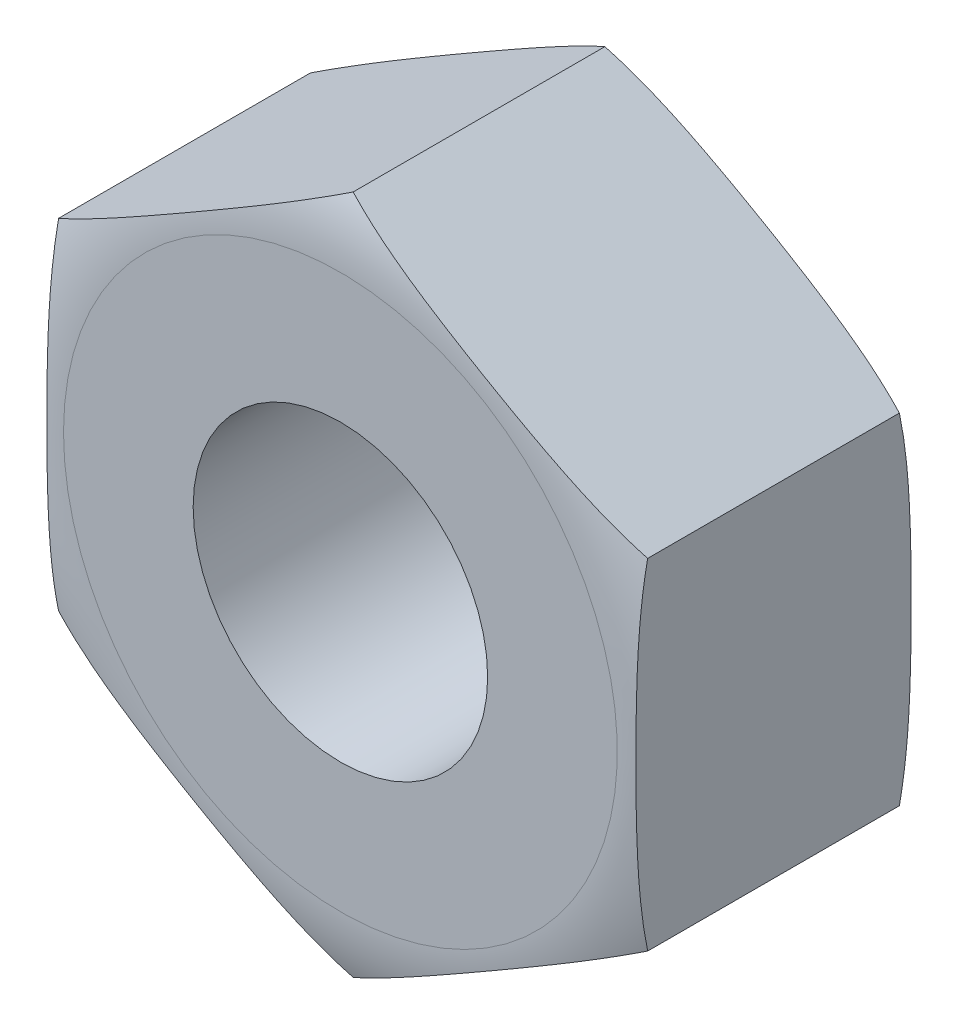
SolidWorks part; units mm, degrees
ref_plane "Ebene vorne" through (0, 0, 0) normal (0, 0, 1) x (1, 0, 0)
ref_plane "Ebene oben" through (0, 0, 0) normal (0, 1, 0) x (1, 0, 0)
ref_plane "Ebene rechts" through (0, 0, 0) normal (1, 0, 0) x (0, 0, -1)
sketch "Skizze1" plane through (0, 0, 0) normal (0, 0, 1) x (1, 0, 0)
  line L1 (8.5, 4.9075) -> (0, 9.815)
  line L2 (0, 9.815) -> (-8.5, 4.9075)
  line L3 (-8.5, 4.9075) -> (-8.5, -4.9075)
  line L4 (-8.5, -4.9075) -> (0, -9.815)
  line L5 (0, -9.815) -> (8.5, -4.9075)
  line L6 (8.5, -4.9075) -> (8.5, 4.9075)
  circle A0 centre (0, 0) radius 8.5 construction
  dimension "D1" = 17
extrude "Aufsatz-Linear austragen1" add sketch "Skizze1" along normal blind 8
hole_wizard "M10 Gewindebohrung1" positions "Skizze2" profile "Skizze3" tap size "M10" standard "DIN"
sketch "Skizze2" plane through (0, 0, 8) normal (0, 0, 1) x (1, 0, 0)
  point P0 (0, 0)
sketch "Skizze3" plane through (0, 0, 8) normal (1, 0, 0) x (0, -1, 0)
  line L0 (0, 0) -> (0, 8)
  line L1 (0, 8) -> (4.25, 8)
  line L2 (4.25, 8) -> (4.25, 0)
  line L5 (4.25, 0) -> (0, 0)
  line L11 (0, -6.35) -> (0, 107.95) construction
  dimension "Bohrerdurchmesser" = 8.5
  dimension "Bohrungstiefe" = 8
sketch "Skizze4" plane through (0, 0, 0) normal (0, 1, 0) x (1, 0, 0)
  line L0 (-10, -7.55) -> (-10, -8)
  line L1 (-10, -8) -> (-7.9915, -8)
  line L2 (-8.5, -8) -> (0, -8) construction
  line L3 (0, -8) -> (-8.5, -8) construction
  line L4 (-8.7093, -4) -> (-0.9115, -4) construction
  line L5 (0, 0) -> (-8.5, 0) construction
  line L6 (-10, 0) -> (-7.9915, 0)
  line L7 (-10, -0.45) -> (-10, 0)
  line L8 (0, -8) -> (0, 0) construction
  line L9 (0, -0.7159) -> (0, -6.0251) construction
  arc A0 (-10, -7.55) -> (-7.9915, -8) centre (-7.9915, -3.2929) ccw
  arc A1 (-10, -0.45) -> (-7.9915, 0) centre (-7.9915, -4.7071) cw
  dimension "D1" = 0.45
  dimension "D2" = 10
revolve "Schnitt-Rotation1" cut sketch "Skizze4" angle 360 about L9
